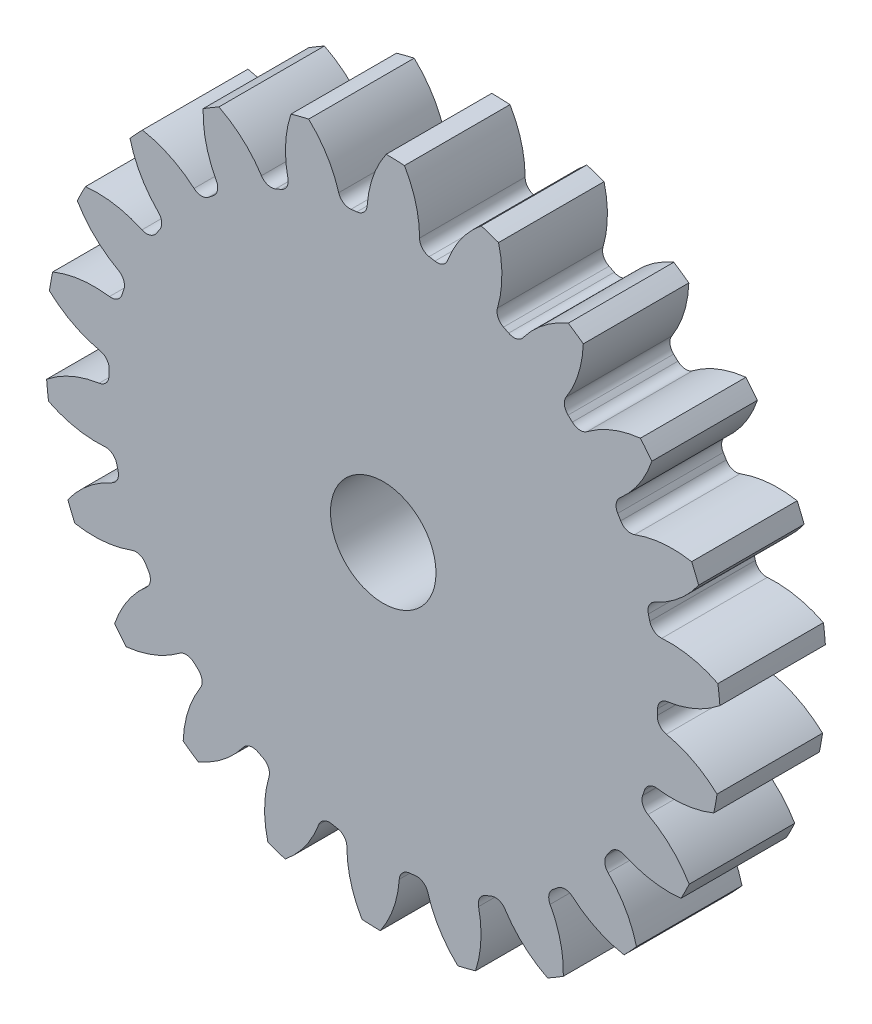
SolidWorks part; units mm, degrees
ref_plane "Front" through (0, 0, 0) normal (0, 0, 1) x (1, 0, 0)
ref_plane "Top" through (0, 0, 0) normal (0, 1, 0) x (1, 0, 0)
ref_plane "Right" through (0, 0, 0) normal (1, 0, 0) x (0, 0, -1)
sketch "Sketch3" plane through (0, 0, 0) normal (0, 0, 1) x (1, 0, 0)
  circle A0 centre (0, 0) radius 406.4
  dimension "od" = 812.8
extrude "gearBody" add sketch "Sketch3" along normal blind 127
sketch "Sketch2" plane through (0, 0, 0) normal (0, 0, 1) x (1, 0, 0)
  line L0 (0, 0) -> (323.4196, 133.9648) construction
  line L1 (402.956, -62.522) -> (0, 0) construction
  line L2 (0, 0) -> (36.3143, 0) construction
  line L3 (372.3005, 13.169) -> (370.4001, -39.8102) construction
  line L5 (371.3503, -13.3206) -> (0, 0) construction
  line L7 (0, 0) -> (350.0668, 0) construction
  arc A0 (350.0084, 6.3952) -> (348.6506, -31.4565) centre (0, 0) ccw construction
  arc A1 (405.1037, 32.4332) -> (401.7388, -61.3752) centre (0, 0) ccw construction
  arc A2 (372.3005, 13.169) -> (370.4001, -39.8102) centre (0, 0) ccw construction
  arc A3 (329.8431, -15.3491) -> (330.0951, -8.3233) centre (0, 0) ccw
  arc A4 (402.956, -62.522) -> (340.6827, -29.4587) centre (312.9899, -156.7932) ccw
  arc A5 (402.956, -62.522) -> (406.4, 33.4898) centre (0, 0) ccw
  arc A6 (406.4, 33.4898) -> (341.9178, 4.9734) centre (323.4196, 133.9648) cw
  arc A7 (330.0951, -8.3233) -> (341.9178, 4.9734) centre (343.8744, -8.6708) cw
  arc A8 (340.6827, -29.4587) -> (329.8431, -15.3491) centre (343.6119, -15.9898) cw
  point P6 (406.4, 33.4898)
  point P22 (402.956, -62.522)
  dimension "baseDia" = 700.1336
  dimension "od" = 812.8
  dimension "pd" = 745.0667
  dimension "rd" = 660.4
  dimension "rFillet" = 13.7837
  dimension "pointX" = 406.4
  dimension "pointY" = 33.4898
  dimension "CTT" = 52.9791
  dimension "flankCenterAngle" = 22.5
extrude "toothCut" cut sketch "Sketch2" along normal through all
pattern_circular "CirPattern1" count 22 over 360 about axis through (0, 0, 0) along (0, 0, 1) of "toothCut"
sketch "hub1Dia" plane through (0, 0, 0) normal (0, 0, -1) x (-1, 0, 0)
  circle A0 centre (0, 0) radius 12.7
  dimension "hub1Dia" = 25.4
sketch "hub2Dia" plane through (0, 0, 127) normal (0, 0, 1) x (1, 0, 0)
  circle A0 centre (0, 0) radius 12.7
  dimension "hub2dia" = 25.4
sketch "boreDia" plane through (0, 0, 0) normal (0, 0, 1) x (1, 0, 0)
  circle A0 centre (0, 0) radius 63.5
  dimension "boreDia" = 127
extrude "bore" cut sketch "boreDia" against normal mid plane 25400
